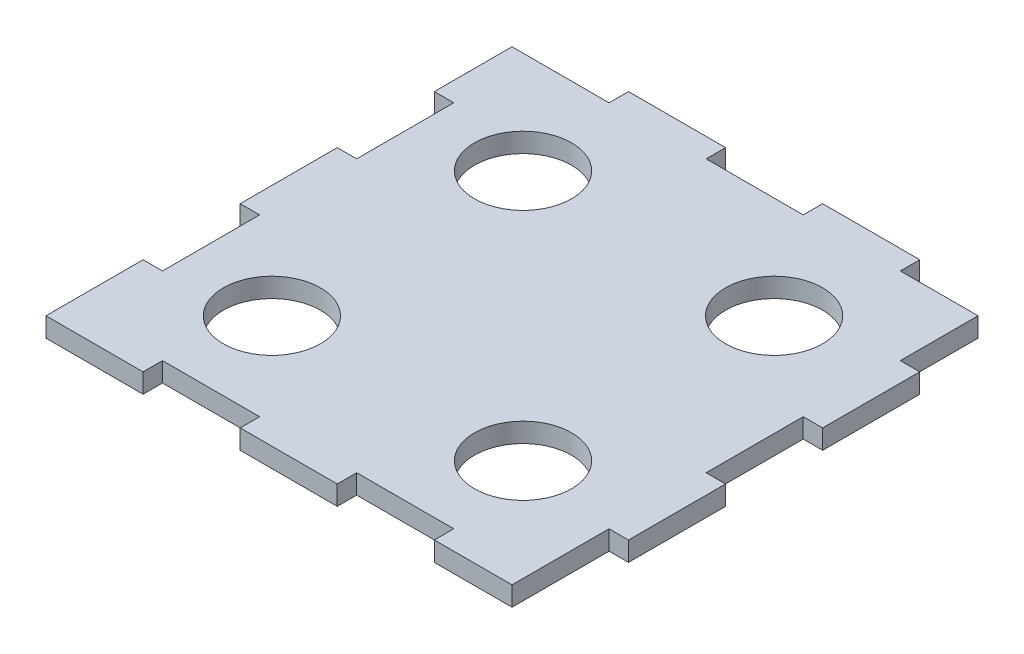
SolidWorks part; units mm, degrees
ref_plane "Front Plane" through (0, 0, 0) normal (0, 0, 1) x (1, 0, 0)
ref_plane "Top Plane" through (0, 0, 0) normal (0, 1, 0) x (1, 0, 0)
ref_plane "Right Plane" through (0, 0, 0) normal (1, 0, 0) x (0, 0, -1)
sketch "Sketch2" plane through (0, 0, 0) normal (0, 1, 0) x (1, 0, 0)
  line L1 (-50, 46) -> (-30, 46)
  line L2 (-50, 46) -> (-50, 30)
  line L3 (-50, -50) -> (-30, -50)
  line L4 (46, 46) -> (46, 30)
  line L8 (-10, -50) -> (-10, -46)
  line L9 (-10, -46) -> (-30, -46)
  line L11 (46, 30) -> (50, 30)
  line L14 (-30, -46) -> (-30, -50)
  line L15 (-10, 46) -> (10, 46)
  line L16 (10, 46) -> (10, 50)
  line L17 (10, 50) -> (30, 50)
  line L18 (30, 50) -> (30, 46)
  line L19 (30, 46) -> (46, 46)
  line L20 (-10, 46) -> (-10, 50)
  line L21 (-10, 50) -> (-30, 50)
  line L22 (-30, 50) -> (-30, 46)
  line L23 (-10, -50) -> (10, -50)
  line L24 (10, -50) -> (10, -46)
  line L25 (10, -46) -> (30, -46)
  line L26 (30, -46) -> (30, -50)
  line L27 (30, -50) -> (46, -50)
  line L29 (50, 30) -> (50, 10)
  line L30 (50, 10) -> (46, 10)
  line L31 (46, 10) -> (46, -10)
  line L32 (46, -10) -> (50, -10)
  line L33 (50, -10) -> (50, -30)
  line L34 (50, -30) -> (46, -30)
  line L35 (46, -30) -> (46, -50)
  line L36 (-50, 30) -> (-46, 30)
  line L37 (-46, 30) -> (-46, 10)
  line L38 (-46, 10) -> (-50, 10)
  line L39 (-50, 10) -> (-50, -10)
  line L40 (-50, -10) -> (-46, -10)
  line L41 (-46, -10) -> (-46, -30)
  line L42 (-46, -30) -> (-50, -30)
  line L43 (-50, -30) -> (-50, -50)
  circle A0 centre (25, 25) radius 10
  circle A1 centre (25, -26.7321) radius 10
  circle A2 centre (-26.7321, -26.7321) radius 10
  circle A3 centre (-26.7321, 25) radius 10
  point P0 (0, 0)
extrude "Boss-Extrude1" add sketch "Sketch2" along normal blind 4
equation "\"Slit thick\"= 4"
equation "\"Slit wide\"= 20"
equation "\"Piece Thick\"= 4"
equation "\"Slit distance\"= 20"
equation "\"D3@Sketch2\"=\"Slit distance\""
equation "\"D4@Sketch2\"=\"Slit distance\""
equation "\"D6@Sketch2\"=\"Slit wide\""
equation "\"D8@Sketch2\"=\"Slit wide\""
equation "\"D10@Sketch2\"=\"Slit wide\""
equation "\"D12@Sketch2\"=\"Slit thick\""
equation "\"D14@Sketch2\"=\"Slit thick\""
equation "\"D15@Sketch2\"=\"Slit wide\""
equation "\"D16@Sketch2\"=\"Slit distance\""
equation "\"D17@Sketch2\"=\"Slit wide\""
equation "\"D18@Sketch2\"=\"Slit distance\""
equation "\"D20@Sketch2\"=\"Slit thick\""
equation "\"D21@Sketch2\"=\"Slit wide\""
equation "\"D22@Sketch2\"=\"Slit distance\""
equation "\"D23@Sketch2\"=\"Slit wide\""
equation "\"D24@Sketch2\"=\"Slit distance\""
equation "\"diam\"= 20"
equation "\"D25@Sketch2\"=\"diam\""
equation "\"D26@Sketch2\"=\"diam\""
equation "\"D27@Sketch2\"=\"diam\""
equation "\"D28@Sketch2\"=\"diam\""
equation "\"D1@Boss-Extrude1\"=\"Piece Thick\""
